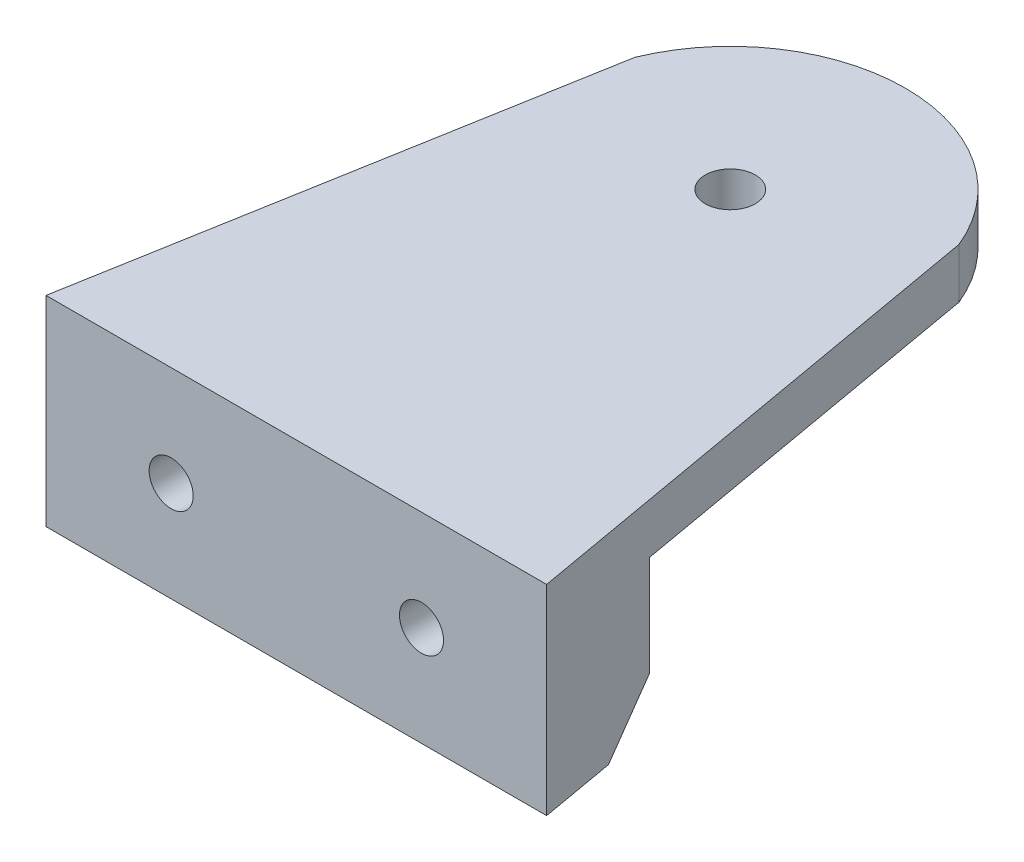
SolidWorks part; units mm, degrees
ref_plane "Alzado" through (0, 0, 0) normal (0, 0, 1) x (1, 0, 0)
ref_plane "Planta" through (0, 0, 0) normal (0, 1, 0) x (1, 0, 0)
ref_plane "Vista lateral" through (0, 0, 0) normal (1, 0, 0) x (0, 0, -1)
sketch "Croquis1" plane through (0, 0, 0) normal (0, 1, 0) x (1, 0, 0)
  line L0 (-50, -50) -> (50, -50)
  line L1 (50, -50) -> (32.3673, 50)
  line L3 (-32.3673, 50) -> (-50, -50)
  arc A0 (-32.3673, 50) -> (32.3673, 50) centre (0, 36.6824) cw
  dimension "D7" = 35
  dimension "D1" = 80
  dimension "D2" = 80
  dimension "D3" = 50
  dimension "D4" = 100
  dimension "D5" = 50
  dimension "D6" = 100
extrude "Extruir1" add sketch "Croquis1" along normal blind 40
hole_wizard "Taladro roscado de M10x1.25-1" positions "Croquis3D1" profile "Croquis4" tap size "M10x1.25" standard "DIN"
sketch3d "Croquis3D1"
  line L0 (-50, 40, 50) -> (-50, 0, 50) construction
  line L1 (-50, 0, 50) -> (50, 0, 50) construction
  line L2 (-50, 40, 50) -> (50, 40, 50) construction
  point P0 (-25, 20, 50)
  point P2 (25, 20, 50)
  dimension "D1" = 25
  dimension "D2" = 50
  dimension "D3" = 20
  dimension "D4" = 20
sketch "Croquis4" plane through (-25, 20, 50) normal (1, 0, 0) x (0, -1, 0)
  line L0 (0, 0) -> (0, 22.6438)
  line L1 (0, 22.6438) -> (4.4, 20)
  line L2 (4.4, 20) -> (4.4, 0)
  line L5 (4.4, 0) -> (0, 0)
  line L10 (0, 22.6438) -> (-4.4, 20) construction
  line L11 (0, -6.35) -> (0, 107.95) construction
  dimension "Diámetro de perforador para roscar" = 8.8
  dimension "Profundidad de perforador para roscar" = 20
  dimension "Ángulo de perforador" = 118
sketch "Croquis5" plane through (0, 40, 0) normal (0, 1, 0) x (1, 0, 0)
  circle A0 centre (0, 36.6824) radius 5
  arc A1 (32.3673, 50) -> (-32.3673, 50) centre (0, 36.6824) ccw construction
  dimension "D1" = 10
extrude "Cortar-Extruir2" cut sketch "Croquis5" against normal blind 40
ref_plane "Plano1" through (50, 0, 0) normal (1, 0, 0) x (0, 0, -1)
sketch "Croquis6" plane through (50, 0, 0) normal (1, 0, 0) x (0, 0, -1)
  line L0 (-50, 40) -> (-50, 0) construction
  line L1 (-25, 30) -> (84.5586, 30)
  line L2 (-25, 30) -> (-25, -10)
  line L3 (-25, -10) -> (84.5586, -10)
  line L4 (84.5586, 30) -> (84.5586, -10)
  point P4 (-50, 20)
  dimension "D1" = 25
  dimension "D2" = 50
  dimension "D3" = 40
extrude "Cortar-Extruir3" cut sketch "Croquis6" against normal through all
chamfer "Chaflán1" distance 10 angle 45 1 edges at (0, 0, 25)
